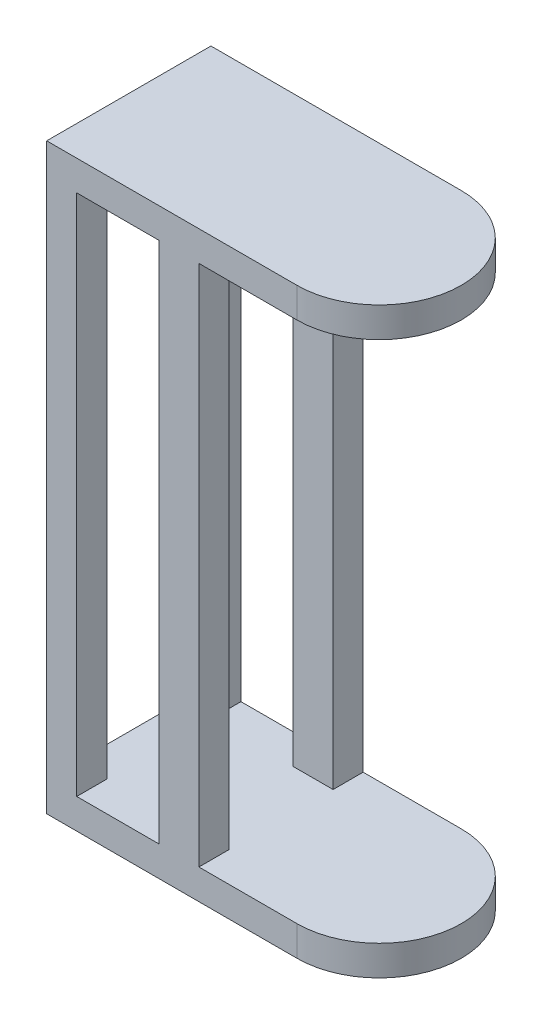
SolidWorks part; units mm, degrees
ref_plane "Ebene vorne" through (0, 0, 0) normal (0, 0, 1) x (1, 0, 0)
ref_plane "Ebene oben" through (0, 0, 0) normal (0, 1, 0) x (1, 0, 0)
ref_plane "Ebene rechts" through (0, 0, 0) normal (1, 0, 0) x (0, 0, -1)
sketch "Skizze1" plane through (0, 0, 0) normal (0, 1, 0) x (1, 0, 0)
  line L0 (0, 41) -> (0, -41) construction
  line L1 (-40, 41) -> (85, 41)
  line L2 (-40, 41) -> (-40, -41)
  line L3 (-40, -41) -> (85, -41)
  line L4 (85, 41) -> (85, -41) construction
  line L5 (0, 0) -> (-40, 0) construction
  arc A0 (85, -41) -> (85, 41) centre (85, 0) ccw
  point P7 (85, 0)
  dimension "D1" = 125
  dimension "D2" = 82
  dimension "D3" = 40
extrude "Linear austragen1" add sketch "Skizze1" along normal mid plane 291
sketch "Skizze2" plane through (0, 0, 41) normal (0, 0, 1) x (1, 0, 0)
  line L0 (126, -145.5) -> (126, 145.5) construction
  line L1 (126, 130.5) -> (36, 130.5)
  line L2 (126, 130.5) -> (126, -130.5)
  line L3 (126, -130.5) -> (36, -130.5)
  line L4 (36, 130.5) -> (36, -130.5)
  line L5 (-40, 145.5) -> (85, 145.5) construction
  point P6 (36, 0)
  dimension "D1" = 15
  dimension "D2" = 90
extrude "Schnitt-Linear austragen1" cut sketch "Skizze2" against normal through all
sketch "Skizze3" plane through (-40, 0, 0) normal (-1, 0, 0) x (0, 0, 1)
  line L8 (-26, -130.5) -> (26, -130.5)
  line L9 (26, -130.5) -> (26, 130.5)
  line L10 (26, 130.5) -> (-26, 130.5)
  line L11 (-26, 130.5) -> (-26, -130.5)
  line L12 (-26, -130.5) -> (26, -130.5)
  line L13 (26, -130.5) -> (26, 130.5)
  line L14 (26, 130.5) -> (-26, 130.5)
  line L15 (-26, 130.5) -> (-26, -130.5)
  dimension "D1" = 15
extrude "Schnitt-Linear austragen2" cut sketch "Skizze3" against normal through all
sketch "Skizze4" plane through (0, 0, 41) normal (0, 0, 1) x (1, 0, 0)
  line L0 (-40, 145.5) -> (-40, -145.5) construction
  line L1 (-25, 130.5) -> (16, 130.5)
  line L2 (-25, 130.5) -> (-25, -130.5)
  line L3 (-25, -130.5) -> (16, -130.5)
  line L4 (16, 130.5) -> (16, -130.5)
  line L5 (-40, 145.5) -> (85, 145.5) construction
  line L6 (36, 130.5) -> (36, -130.5) construction
  point P10 (-25, 0)
  dimension "D1" = 15
  dimension "D2" = 15
  dimension "D3" = 20
extrude "Schnitt-Linear austragen3" cut sketch "Skizze4" against normal through all
